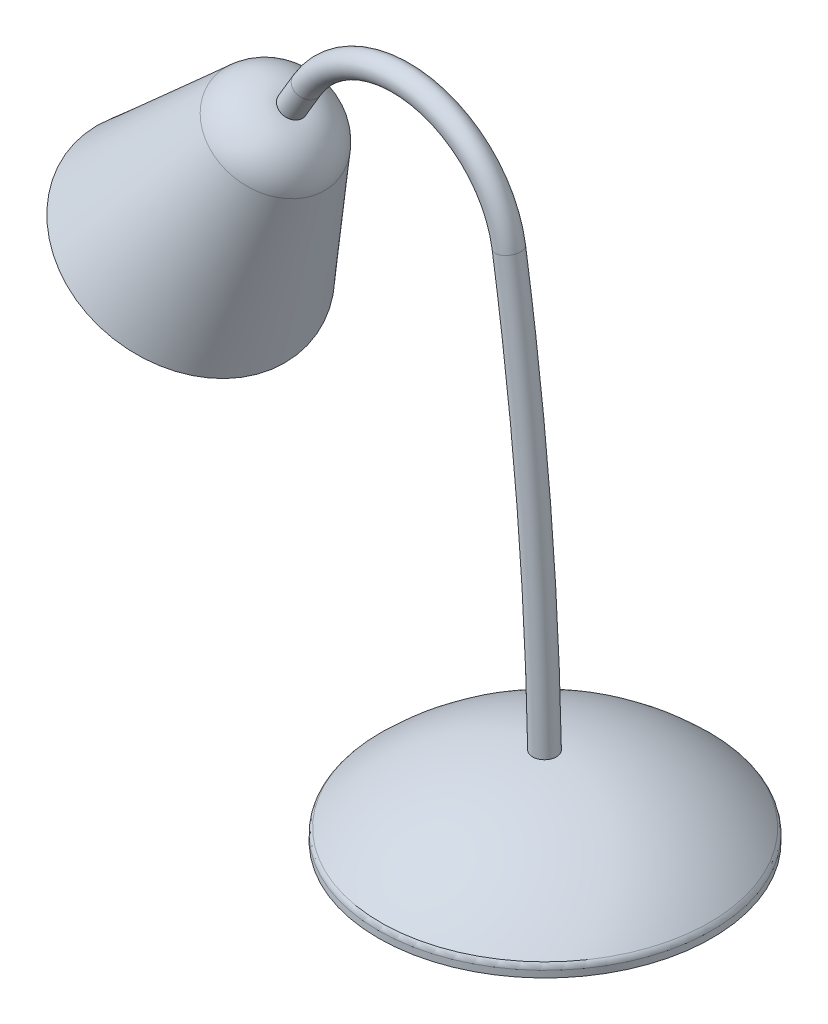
SolidWorks part; units mm, degrees
ref_plane "Front Plane" through (0, 0, 0) normal (0, 0, 1) x (1, 0, 0)
ref_plane "Top Plane" through (0, 0, 0) normal (0, 1, 0) x (1, 0, 0)
ref_plane "Right Plane" through (0, 0, 0) normal (1, 0, 0) x (0, 0, -1)
sketch "Sketch2" plane through (0, 0, 0) normal (0, 0, 1) x (1, 0, 0)
  line L0 (0, 0) -> (0, 62.4335) construction
  line L1 (0, 19.0132) -> (-106.68, 19.0132)
  line L2 (-106.68, 19.0132) -> (-106.68, 25.3632)
  line L3 (0, 69.8132) -> (-105.805, 69.8132) construction
  line L4 (-105.805, 69.8132) -> (81.814, 69.8132) construction
  line L5 (0, 69.8132) -> (0, 19.0132)
  arc A0 (-106.68, 25.3632) -> (0, 69.8132) centre (0, -80.4278) cw
  dimension "D3" = 50.8
  dimension "D1" = 106.68
  dimension "D2" = 6.35
revolve "Revolve1" add sketch "Sketch2" angle 360 about L0
sketch "Sketch3" plane through (0, 19.0132, 0) normal (0, -1, 0) x (1, 0, 0)
  circle A0 centre (0, 0) radius 7.62
  dimension "D1" = 15.24
sketch "Sketch4" plane through (0, 0, 0) normal (0, 0, 1) x (1, 0, 0)
  line L0 (0, 19.0132) -> (0, 30.4669)
  line L1 (-7.62, 19.0132) -> (7.62, 19.0132) construction
  line L2 (-152.3075, 361.7867) -> (-161.7319, 345.9191)
  arc A0 (0, 30.4669) -> (-23.1991, 336.6419) centre (-2032, 30.4669) ccw
  arc A1 (-23.1991, 336.6419) -> (-152.3075, 361.7867) centre (-92.2517, 326.1171) ccw
  point P9 (0, 0)
  dimension "D1" = 69.85
  dimension "D2" = 2032
sweep "Sweep1" add profiles "Sketch3" path "Sketch4"
sketch "Sketch5" plane through (0, 0, 0) normal (0, 0, 1) x (1, 0, 0)
  line L0 (-161.6218, 345.8536) -> (-168.1733, 349.7449)
  line L2 (-203.8005, 346.2871) -> (-286.5314, 272.3308)
  line L3 (-286.5314, 272.3308) -> (-226.4756, 236.6612)
  line L4 (-161.6218, 345.8536) -> (-210.6819, 263.2525) construction
  line L5 (-161.6218, 345.8536) -> (-226.4756, 236.6612)
  arc A0 (-168.1733, 349.7449) -> (-203.8005, 346.2871) centre (-183.6291, 323.7224) ccw
  dimension "D1" = 127
  dimension "D2" = 69.85
revolve "Revolve2" add sketch "Sketch5" angle 360 about L5
shell "Shell1" thickness 2.54
fillet "Fillet1" radius 5.08 1 edges at (0, 25.3632, -106.68)
